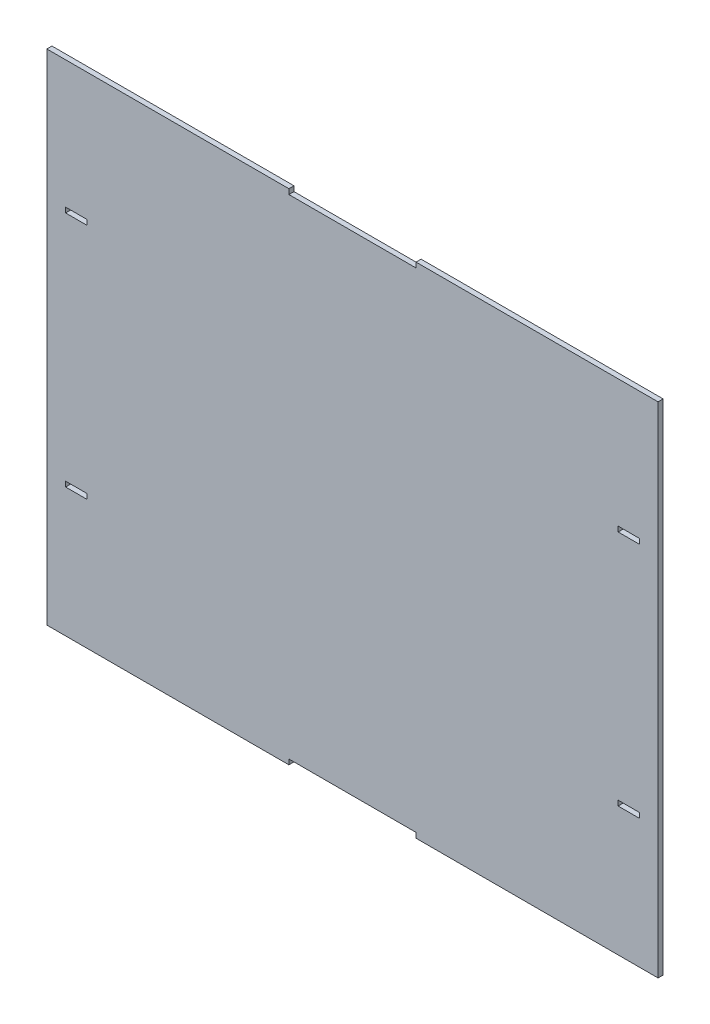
SolidWorks part; units mm, degrees
ref_plane "Front Plane" through (0, 0, 0) normal (0, 0, 1) x (1, 0, 0)
ref_plane "Top Plane" through (0, 0, 0) normal (0, 1, 0) x (1, 0, 0)
ref_plane "Right Plane" through (0, 0, 0) normal (1, 0, 0) x (0, 0, -1)
sketch "Sketch1" plane through (0, 0, 0) normal (0, 0, 1) x (1, 0, 0)
  line L0 (208.026, -149.6234) -> (135.4314, -149.6234)
  line L1 (318.7206, 0) -> (246.126, 0)
  line L2 (318.7206, 0) -> (318.7206, -149.6234)
  line L3 (318.7206, -149.6234) -> (246.126, -149.6234)
  line L4 (135.4314, 0) -> (135.4314, -149.6234)
  line L5 (147.4085, -110.9536) -> (141.0585, -110.9536)
  line L6 (147.4085, -110.9536) -> (147.4085, -109.4296)
  line L7 (147.4085, -109.4296) -> (141.0585, -109.4296)
  line L8 (141.0585, -110.9536) -> (141.0585, -109.4296)
  line L9 (147.4085, -39.784) -> (141.0585, -39.784)
  line L10 (147.4085, -39.784) -> (147.4085, -38.26)
  line L11 (147.4085, -38.26) -> (141.0585, -38.26)
  line L12 (141.0585, -39.784) -> (141.0585, -38.26)
  line L13 (313.0935, -38.26) -> (306.7435, -38.26)
  line L14 (313.0935, -38.26) -> (313.0935, -39.784)
  line L15 (313.0935, -39.784) -> (306.7435, -39.784)
  line L16 (306.7435, -38.26) -> (306.7435, -39.784)
  line L17 (313.0935, -109.4296) -> (306.7435, -109.4296)
  line L18 (313.0935, -109.4296) -> (313.0935, -110.9536)
  line L19 (313.0935, -110.9536) -> (306.7435, -110.9536)
  line L20 (306.7435, -109.4296) -> (306.7435, -110.9536)
  line L21 (208.026, -148.0994) -> (246.126, -148.0994)
  line L22 (208.026, -148.0994) -> (208.026, -149.6234)
  line L23 (208.026, 0) -> (135.4314, 0)
  line L24 (246.126, -148.0994) -> (246.126, -149.6234)
  line L25 (246.126, -1.524) -> (208.026, -1.524)
  line L26 (246.126, -1.524) -> (246.126, 0)
  line L28 (208.026, -1.524) -> (208.026, 0)
extrude "Boss-Extrude1" add sketch "Sketch1" along normal blind 1.524
